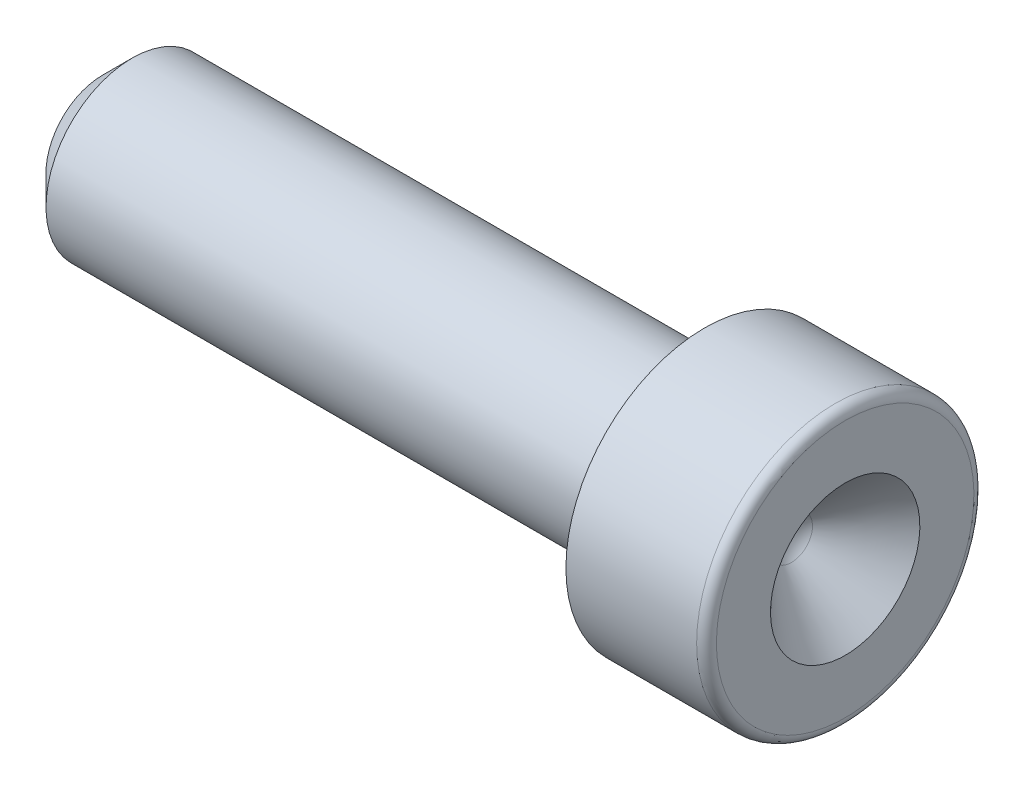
SolidWorks part; units mm, degrees
ref_plane "Front Plane" through (0, 0, 0) normal (0, 0, 1) x (1, 0, 0)
ref_plane "Top Plane" through (0, 0, 0) normal (0, 1, 0) x (1, 0, 0)
ref_plane "Right Plane" through (0, 0, 0) normal (1, 0, 0) x (0, 0, -1)
sketch "Sketch1" plane through (0, 0, 0) normal (0, 0, 1) x (1, 0, 0)
  line L0 (0.762, 0) -> (14.9352, 0)
  line L1 (15.4432, 0.508) -> (15.4432, 1.3462)
  line L2 (15.4432, 1.3462) -> (18.796, 1.3462)
  line L3 (19.05, 1.0922) -> (19.05, -2.2098)
  line L4 (79.8278, -2.2098) -> (31.5985, -2.2098) construction
  line L5 (0, -0.762) -> (0, -2.2098)
  line L6 (0, -2.2098) -> (19.05, -2.2098)
  line L7 (0, -0.762) -> (0.762, 0)
  line L8 (17.673, -1.671) -> (19.05, -0.294)
  arc A0 (14.9352, 0) -> (15.4432, 0.508) centre (14.9352, 0.508) ccw
  arc A1 (17.4498, -2.2098) -> (17.673, -1.671) centre (18.2118, -2.2098) cw
  arc A2 (19.05, 1.0922) -> (18.796, 1.3462) centre (18.796, 1.0922) ccw
  point P0 (0, 0)
  point P19 (19.05, 1.3462)
  dimension "D1" = 0.508
  dimension "D7" = 0.762
  dimension "D11" = 0.254
  dimension "D2" = 19.05
  dimension "D3" = 4.4196
  dimension "D4" = 3.6068
  dimension "D5" = 0.762
  dimension "D6" = 45
  dimension "D8" = 1.6002
  dimension "D9" = 45
  dimension "D10" = 3.556
revolve "Revolve1" add sketch "Sketch1" angle 360 about L4
